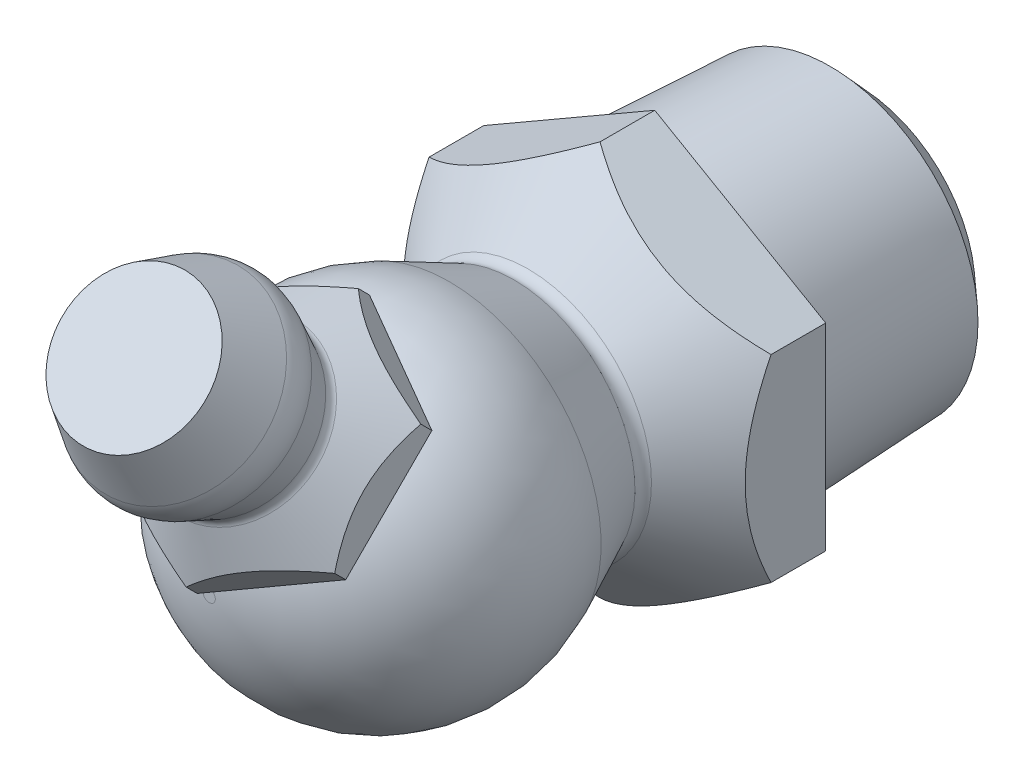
SolidWorks part; units mm, degrees
ref_plane "Plane1" through (0, 0, 0) normal (0, 0, 1) x (1, 0, 0)
ref_plane "Plane2" through (0, 0, 0) normal (0, 1, 0) x (1, 0, 0)
ref_plane "Plane3" through (0, 0, 0) normal (1, 0, 0) x (0, 0, -1)
sketch "Sketch1" plane through (0, 0, 0) normal (0, 0, 1) x (1, 0, 0)
  line L1 (5.5562, 3.2079) -> (0, 6.4158)
  line L2 (0, 6.4158) -> (-5.5562, 3.2079)
  line L3 (-5.5562, 3.2079) -> (-5.5562, -3.2079)
  line L4 (-5.5562, -3.2079) -> (0, -6.4158)
  line L5 (0, -6.4158) -> (5.5563, -3.2079)
  line L6 (5.5563, -3.2079) -> (5.5562, 3.2079)
  circle A0 centre (0, 0) radius 5.5562 construction
  dimension "D1" = 11.1125
extrude "Base-Extrude" add sketch "Sketch1" along normal blind 21.082
sketch "Sketch2" plane through (0, 0, 0) normal (1, 0, 0) x (0, 0, -1)
  line L0 (0, 0) -> (-21.082, 0) construction
  line L1 (-13.2781, 4.9312) -> (-11.1785, 3.932)
  line L2 (-21.082, 6.4158) -> (-8.382, 6.4158)
  line L3 (-21.082, 6.4158) -> (-21.082, 0.1984)
  line L4 (-8.382, 6.4158) -> (-10.7237, 4.0134)
  arc A0 (-21.082, 0.1984) -> (-13.2781, 4.9312) centre (-15.6246, 0) cw
  arc A1 (-10.7237, 4.0134) -> (-11.1785, 3.932) centre (-11.0079, 4.2904) cw
  point P10 (-10.922, 3.81)
  point P12 (-10.922, 3.81)
  point P15 (-15.6246, 0)
  dimension "D1" = 5.461
  dimension "D5" = 7.62
  dimension "D7" = 0.3969
  dimension "D2" = 12.7
  dimension "D3" = 2.54
  dimension "D4" = 0.1984
  dimension "D8" = 15.6246
revolve "Cut-Revolve1" cut sketch "Sketch2" angle 360 about L0
sketch "Sketch3" plane through (0, 0, 0) normal (1, 0, 0) x (0, 0, -1)
  line L0 (0, 0) -> (-6.604, 0) construction
  line L1 (0, 6.4158) -> (-6.604, 6.4158)
  line L2 (0, 6.4158) -> (0, 4.7625)
  line L3 (0, 4.7625) -> (-6.604, 5.08)
  line L4 (-6.604, 6.4158) -> (-6.604, 5.08)
  dimension "D1" = 10.16
  dimension "D2" = 6.604
  dimension "D3" = 9.525
revolve "Cut-Revolve2" cut sketch "Sketch3"
chamfer "Chamfer1" distance 0.9071 angle 45
sketch "Sketch7" plane through (0, 0, 0) normal (1, 0, 0) x (0, 0, -1)
  line L0 (-15.621, 0) -> (-23.6532, 8.0322) construction
  line L1 (0, 0) -> (-21.082, 0) construction
  line L2 (-15.621, 0) -> (0, 0) construction
  line L3 (-16.8782, 8.4414) -> (-20.4703, 4.8493)
  line L4 (-16.8782, 8.4414) -> (-15.0822, 6.6454)
  line L5 (-20.4703, 4.8493) -> (-18.6743, 3.0533)
  line L6 (-15.0822, 6.6454) -> (-18.6743, 3.0533)
  dimension "D1" = 135
  dimension "D2" = 5.08
  dimension "D3" = 2.54
  dimension "D4" = 4.318
  dimension "D5" = 15.621
revolve "Cut-Revolve3" cut sketch "Sketch7" angle 360 about L0
sketch "Sketch10" plane through (0, 10.8638, 10.8638) normal (0, 0.7071, 0.7071) x (1, 0, 0)
  circle A0 centre (0, -11.0483) radius 3.3466 construction
  point P0 (0, -11.0483)
sketch "Sketch25" plane through (0.6975, 3.3284, 18.3992) normal (0, 0.7071, 0.7071) x (1, 0, 0)
  line L1 (-0.6975, 3.5705) -> (-4.1265, 1.5907)
  line L2 (-4.1265, 1.5907) -> (-4.1265, -2.3687)
  line L3 (-4.1265, -2.3687) -> (-0.6975, -4.3485)
  line L4 (-0.6975, -4.3485) -> (2.7315, -2.3687)
  line L5 (2.7315, -2.3687) -> (2.7315, 1.5907)
  line L6 (2.7315, 1.5907) -> (-0.6975, 3.5705)
  circle A0 centre (-0.6975, -0.389) radius 3.429 construction
  point P1 (2.7315, -0.389)
  dimension "D1" = 6.858
extrude "Boss-Extrude8" add sketch "Sketch25" along normal blind 6.858
sketch "Sketch26" plane through (0, 0, 0) normal (1, 0, 0) x (0, 0, -1)
  line L0 (-20.7239, 10.7024) -> (-16.2337, 6.2123)
  line L1 (-16.2337, 6.2123) -> (-18.3073, 6.4135)
  line L2 (-19.3424, 8.0679) -> (-18.624, 6.631)
  line L3 (-20.1404, 8.8186) -> (-21.8709, 9.5553)
  line L4 (-21.8709, 9.5553) -> (-20.7239, 10.7024)
  line L5 (-22.1237, 9.3025) -> (-24.9235, 6.5027) construction
  line L6 (-18.6743, 3.0533) -> (-23.5236, 7.9026) construction
  line L7 (-20.7239, 10.7024) -> (-15.8745, 5.8531) construction
  arc A0 (-18.624, 6.631) -> (-18.3073, 6.4135) centre (-18.269, 6.8085) ccw
  arc A1 (-19.3424, 8.0679) -> (-20.1404, 8.8186) centre (-20.7623, 7.3579) ccw
  dimension "D2" = 1.5875
  dimension "D3" = 0.3969
  dimension "D1" = 68.062
  dimension "D4" = 39.458
  dimension "D5" = 1.8808
  dimension "D6" = 2.0833
  dimension "D7" = 18.435
  dimension "D8" = 1.6065
revolve "Cut-Revolve11" cut sketch "Sketch26" angle 360 about L6
